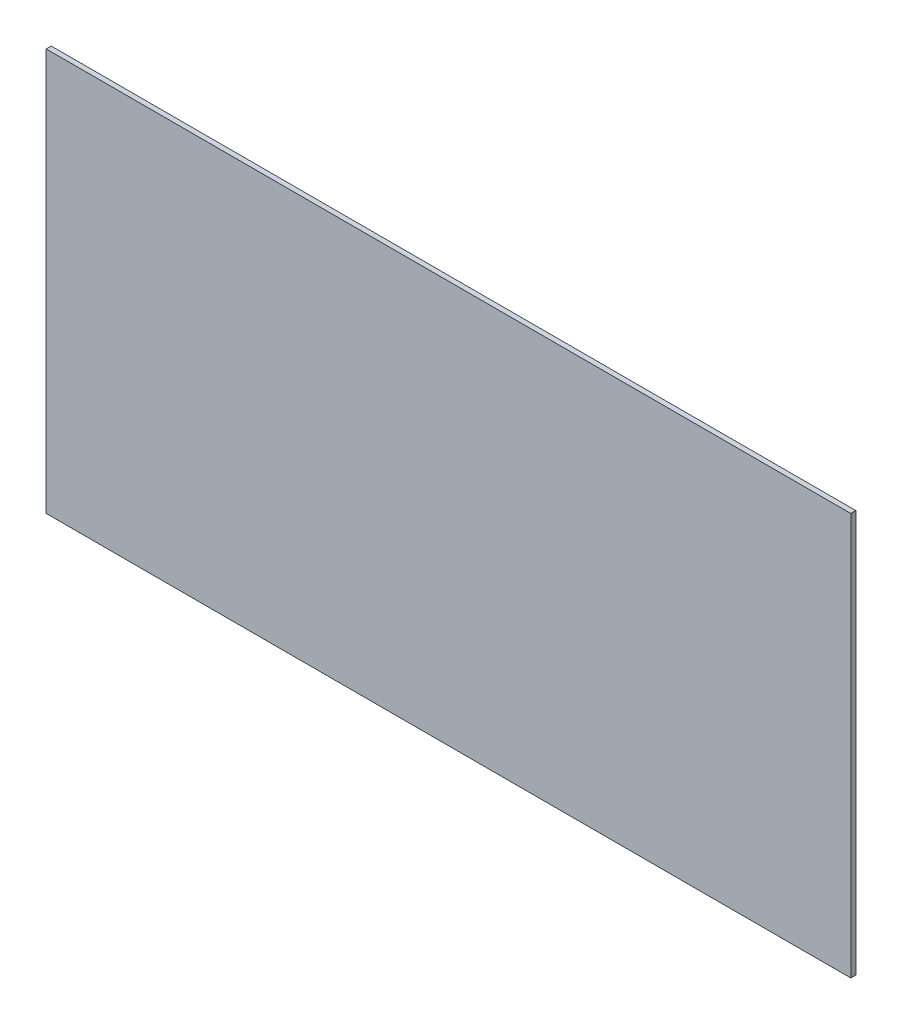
SolidWorks part; units mm, degrees
ref_plane "Front Plane" through (0, 0, 0) normal (0, 0, 1) x (1, 0, 0)
ref_plane "Top Plane" through (0, 0, 0) normal (0, 1, 0) x (1, 0, 0)
ref_plane "Right Plane" through (0, 0, 0) normal (1, 0, 0) x (0, 0, -1)
sketch "Sketch1" plane through (0, 0, 0) normal (0, 0, 1) x (1, 0, 0)
  line L1 (-798.7676, 460.1009) -> (1233.2324, 460.1009)
  line L2 (-798.7676, 460.1009) -> (-798.7676, -555.8991)
  line L3 (-798.7676, -555.8991) -> (1233.2324, -555.8991)
  line L4 (1233.2324, 460.1009) -> (1233.2324, -555.8991)
  dimension "D1" = 2032
  dimension "D2" = 1016
extrude "Boss-Extrude1" add sketch "Sketch1" along normal blind 12.7
